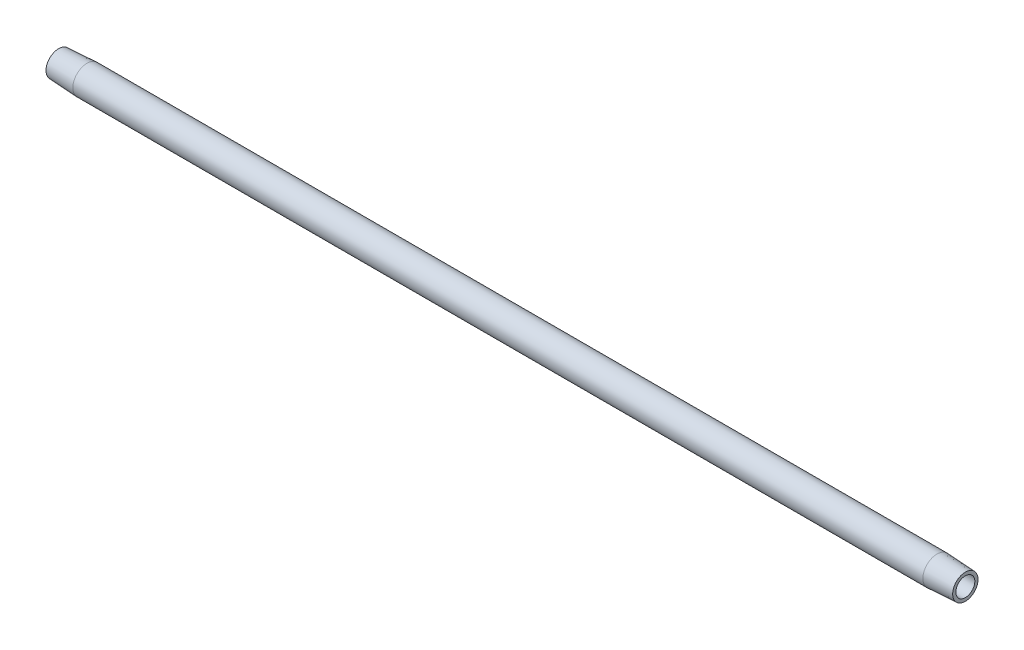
SolidWorks part; units mm, degrees
ref_plane "Front Plane" through (0, 0, 0) normal (0, 0, 1) x (1, 0, 0)
ref_plane "Top Plane" through (0, 0, 0) normal (0, 1, 0) x (1, 0, 0)
ref_plane "Right Plane" through (0, 0, 0) normal (1, 0, 0) x (0, 0, -1)
sketch "Sketch2" plane through (0, 0, 0) normal (0, 0, 1) x (1, 0, 0)
  line L0 (0.4761, 0) -> (50000.4761, 0) construction
  line L1 (0, -11.3625) -> (0, 49988.6375) construction
  line L7 (7.9375, 3.9687) -> (0, 3.5528)
  line L8 (246.0625, 3.9688) -> (7.9375, 3.9687)
  line L9 (254, 3.5528) -> (246.0625, 3.9688)
  line L10 (254, 2.6543) -> (254, 3.5528)
  line L11 (254, 2.6543) -> (0, 2.6543)
  line L12 (0, 3.5528) -> (0, 2.6543)
  dimension "D1" = 5.3086
  dimension "D2" = 7.9375
  dimension "D3" = 3
  dimension "D4" = 3
  dimension "D5" = 7.9375
  dimension "D6" = 7.9375
  dimension "D7" = 254
revolve "Revolve1" add sketch "Sketch2" angle 360 about L0
